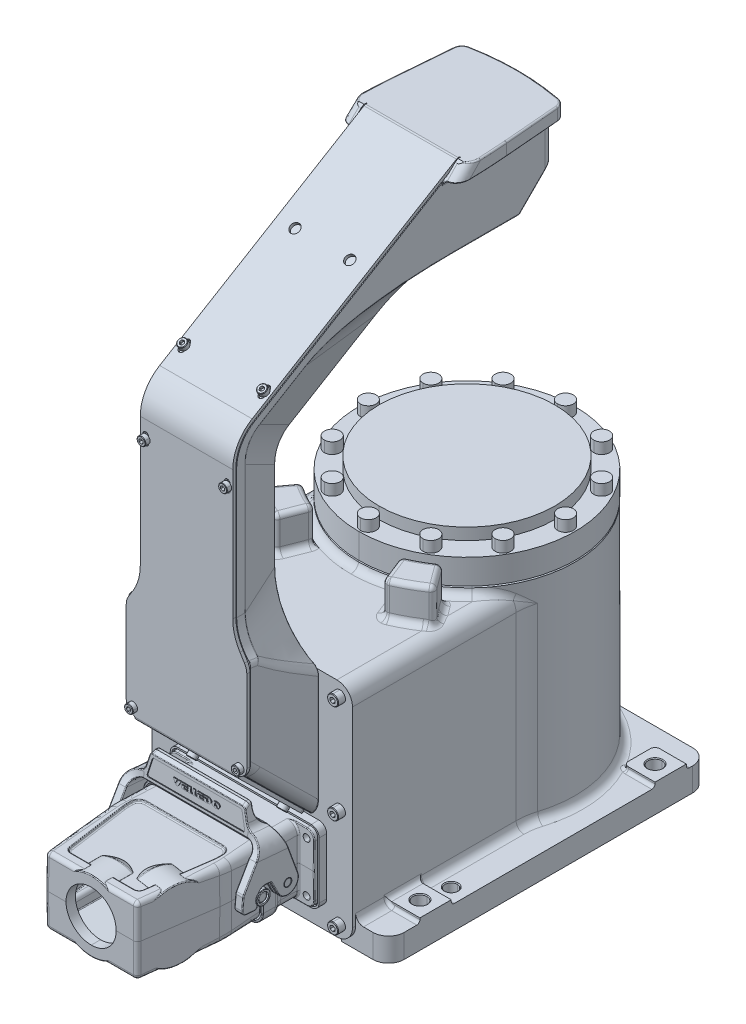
SolidWorks part; units mm, degrees
ref_plane "前视基准面" through (0, 0, 0) normal (0, 0, 1) x (1, 0, 0)
ref_plane "上视基准面" through (0, 0, 0) normal (0, 1, 0) x (1, 0, 0)
ref_plane "右视基准面" through (0, 0, 0) normal (1, 0, 0) x (0, 0, -1)
imported_body "输入1"
other "移动面1" parameters "D1"=8.8
